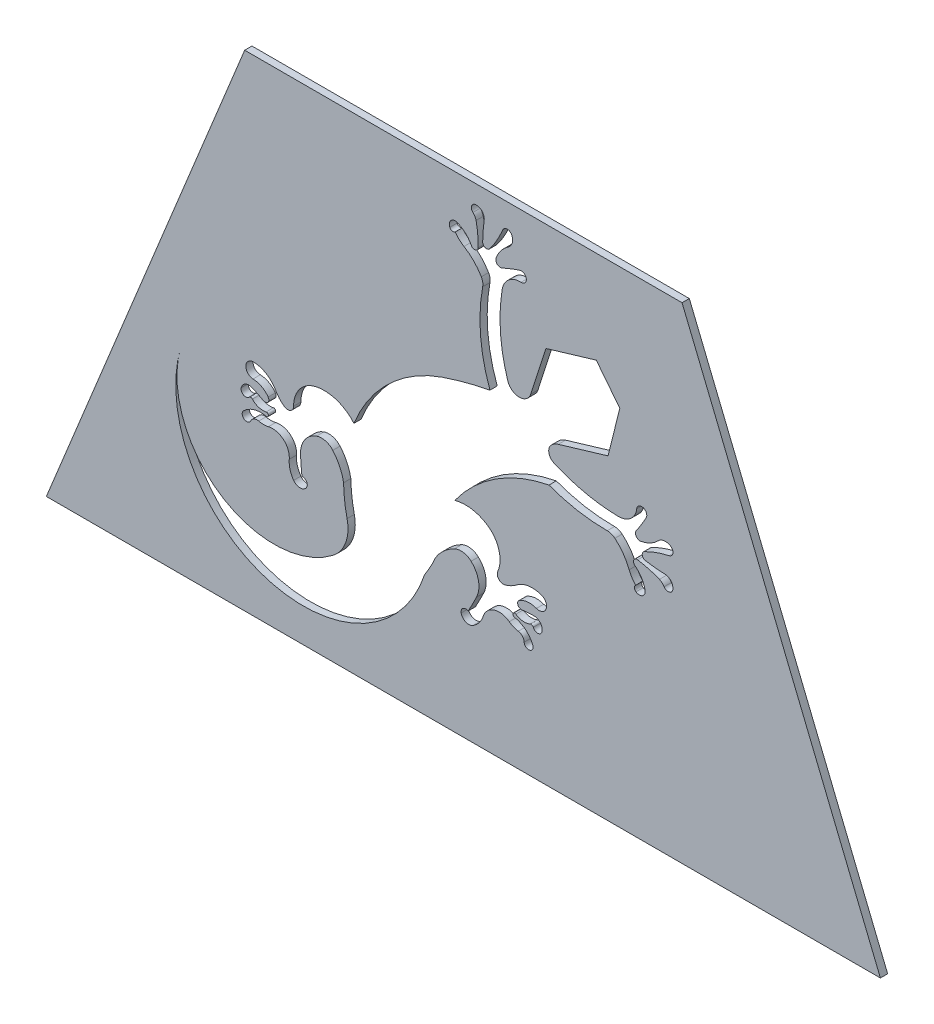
SolidWorks part; units mm, degrees
ref_plane "Front Plane" through (0, 0, 0) normal (0, 0, 1) x (1, 0, 0)
ref_plane "Top Plane" through (0, 0, 0) normal (0, 1, 0) x (1, 0, 0)
ref_plane "Right Plane" through (0, 0, 0) normal (1, 0, 0) x (0, 0, -1)
sketch "Model" plane through (0, 0, 0) normal (0, 0, 1) x (1, 0, 0)
  line L0 (77.3625, 1404.6306) -> (97.9103, 1378.4881)
  line L1 (97.9103, 1378.4881) -> (87.6364, 1337.298)
  line L2 (77.3625, 1404.6306) -> (33.3316, 1391.5022)
  line L3 (33.3316, 1391.5022) -> (20.0415, 1350.2377)
  line L4 (87.6364, 1337.298) -> (44.1906, 1324.3441)
  line L32 (-403.4791, 1061.0287) -> (325.7465, 1061.0287)
  line L33 (325.7465, 1061.0287) -> (152.3405, 1485.635)
  line L34 (-403.4791, 1061.0287) -> (-230.0732, 1485.635)
  line L35 (-230.0732, 1485.635) -> (152.3405, 1485.635)
  arc A0 (44.1906, 1324.3441) -> (38.0009, 1320.6636) centre (48.4039, 1310.2131) ccw
  arc A1 (20.0415, 1350.2377) -> (0, 1350.2377) centre (10.0208, 1353.4651) cw
  arc A2 (0, 1350.2377) -> (-6.7675, 1391.5022) centre (134.0391, 1393.4077) cw
  arc A3 (-46.6936, 1199.7645) -> (-63.0447, 1185.1547) centre (-28.8124, 1163.2973) ccw
  arc A4 (-134.5557, 1250.8437) -> (-167.3054, 1262.0877) centre (-160.5312, 1228.5025) ccw
  arc A5 (-34.6238, 1158.7666) -> (-27.4172, 1172.761) centre (-353.3472, 1331.7503) ccw
  arc A6 (-40.8021, 1154.1136) -> (-34.6238, 1158.7666) centre (-36.6514, 1155.0307) cw
  arc A7 (-30.4945, 1149.7926) -> (-40.8021, 1154.1136) centre (-34.1241, 1155.5891) cw
  arc A8 (-21.5605, 1161.2621) -> (-30.4945, 1149.7926) centre (-41.7576, 1167.7801) cw
  arc A9 (1.2378, 1168.5995) -> (-21.5605, 1161.2621) centre (-7.5225, 1156.7317) ccw
  arc A10 (9.1107, 1165.2992) -> (1.2378, 1168.5995) centre (11.9489, 1183.11) cw
  arc A11 (14.2698, 1159.5274) -> (9.1107, 1165.2992) centre (8.146, 1159.2452) ccw
  arc A12 (21.7882, 1161.2217) -> (14.2698, 1159.5274) centre (18.1793, 1159.7075) cw
  arc A13 (-134.5557, 1250.8437) -> (-57.4112, 1324.3441) centre (-15.9404, 1203.5823) cw
  arc A14 (-181.2539, 1203.7013) -> (-167.3054, 1224.8383) centre (-160.0909, 1204.9065) cw
  arc A15 (-167.3054, 1224.8383) -> (-153.0365, 1221.1526) centre (-162.8642, 1212.5685) cw
  arc A16 (-167.3054, 1262.0877) -> (-187.2958, 1237.4819) centre (-162.3787, 1237.6618) ccw
  arc A17 (-187.2958, 1237.4819) -> (-195.6404, 1233.2911) centre (-192.5015, 1237.4443) cw
  arc A18 (-195.6404, 1233.2911) -> (-203.2139, 1241.9514) centre (-178.6085, 1255.8272) cw
  arc A19 (35.9997, 1289.4046) -> (-46.351, 1236.589) centre (60.7967, 1160.1318) ccw
  arc A20 (-72.8009, 1167.0778) -> (-285.9602, 1232.9045) centre (-178.775, 1201.9522) cw
  arc A21 (-285.9602, 1232.9045) -> (-153.0365, 1141.5992) centre (-204.3314, 1209.3322) ccw
  arc A22 (-153.0365, 1141.5992) -> (-140.5423, 1175.6968) centre (-173.306, 1168.3643) ccw
  arc A23 (-140.5423, 1175.6968) -> (-143.6051, 1201.3573) centre (-15.9404, 1203.5823) cw
  arc A24 (-57.4112, 1324.3441) -> (-15.6188, 1335.4517) centre (41.5562, 1036.1543) cw
  arc A25 (-203.2139, 1241.9514) -> (-222.4563, 1253.3739) centre (-222.7728, 1230.9215) ccw
  arc A26 (-222.4563, 1253.3739) -> (-222.7728, 1240.3491) centre (-222.5482, 1246.8599) ccw
  arc A27 (-222.7728, 1240.3491) -> (-209.568, 1233.2911) centre (-223.3587, 1223.3716) cw
  arc A28 (-209.568, 1233.2911) -> (-213.8023, 1228.5025) centre (-212.2286, 1231.3773) cw
  arc A29 (-213.8023, 1228.5025) -> (-223.3587, 1233.2911) centre (-284.425, 1099.4918) ccw
  arc A30 (-223.3587, 1233.2911) -> (-233.1071, 1228.5025) centre (-226.2727, 1226.9063) ccw
  arc A31 (-233.1071, 1228.5025) -> (-226.2727, 1224.8383) centre (-229.1972, 1227.5894) ccw
  arc A32 (-226.2727, 1224.8383) -> (-223.3587, 1224.8383) centre (-224.8157, 1223.4677) cw
  arc A33 (-223.3587, 1224.8383) -> (-211.3109, 1221.1139) centre (-214.053, 1233.5921) ccw
  arc A34 (-211.3109, 1221.1139) -> (-211.3109, 1217.8633) centre (-210.9537, 1219.4886) cw
  arc A35 (-211.3109, 1217.8633) -> (-224.8157, 1216.4111) centre (-215.8971, 1196.9933) ccw
  arc A36 (-224.8157, 1216.4111) -> (-231.0945, 1212.0826) centre (-215.5705, 1196.2823) ccw
  arc A37 (-231.0945, 1212.0826) -> (-224.8157, 1207.6133) centre (-228.3516, 1209.2909) ccw
  arc A38 (-224.8157, 1207.6133) -> (-217.8263, 1210.9418) centre (-219.2772, 1204.9856) cw
  arc A39 (-217.8263, 1210.9418) -> (-209.2897, 1210.9418) centre (-213.558, 1228.4649) ccw
  arc A40 (-209.2897, 1210.9418) -> (-191.1008, 1195.3608) centre (-205.7987, 1196.6099) cw
  arc A41 (-191.1008, 1195.3608) -> (-187.2957, 1181.3292) centre (-169.9542, 1193.5636) ccw
  arc A42 (-187.2957, 1181.3292) -> (-176.1191, 1181.3292) centre (-181.7074, 1185.2717) ccw
  arc A43 (-176.1191, 1181.3292) -> (-180.018, 1188.009) centre (-179.5924, 1183.7796) ccw
  arc A44 (-180.018, 1188.009) -> (-181.2539, 1203.7013) centre (180.7997, 1224.3202) cw
  arc A45 (-153.0365, 1221.1526) -> (-143.6051, 1201.3573) centre (-183.6259, 1194.4341) cw
  arc A46 (17.6711, 1167.641) -> (21.7882, 1161.2217) centre (1.3628, 1152.6517) cw
  arc A47 (5.7778, 1174.2015) -> (17.6711, 1167.641) centre (1.9389, 1153.1811) cw
  arc A48 (7.0345, 1177.1992) -> (5.7778, 1174.2015) centre (6.0768, 1175.8384) ccw
  arc A49 (19.5855, 1175.9763) -> (7.0345, 1177.1992) centre (14.3876, 1187.6471) cw
  arc A50 (22.2729, 1174.8497) -> (19.5855, 1175.9763) centre (20.3993, 1174.149) ccw
  arc A51 (29.9925, 1175.5868) -> (22.2729, 1174.8497) centre (26.0336, 1176.2562) cw
  arc A52 (22.8534, 1183.7718) -> (29.9925, 1175.5868) centre (23.0724, 1176.7569) cw
  arc A53 (12.1888, 1183.0502) -> (22.8534, 1183.7718) centre (27.4432, 1036.7674) cw
  arc A54 (10.135, 1189.1034) -> (12.1888, 1183.0502) centre (11.8489, 1186.3099) ccw
  arc A55 (25.0418, 1190.5075) -> (10.135, 1189.1034) centre (19.0184, 1174.6236) ccw
  arc A56 (29.7854, 1202.6419) -> (25.0418, 1190.5075) centre (27.3517, 1196.5989) cw
  arc A57 (7.6232, 1199.5469) -> (29.7854, 1202.6419) centre (21.397, 1181.813) cw
  arc A58 (-72.8009, 1167.0778) -> (-63.0447, 1185.1547) centre (-179.9225, 1236.5631) ccw
  arc A59 (-2.7097, 1194.488) -> (7.6232, 1199.5469) centre (-9.7044, 1221.8565) ccw
  arc A60 (-8.7852, 1201.579) -> (-2.7097, 1194.488) centre (-3.9987, 1199.5317) ccw
  arc A61 (-17.7083, 1232.0001) -> (-8.7852, 1201.579) centre (-31.6953, 1211.3782) cw
  arc A62 (-32.1093, 1197.6471) -> (-46.6936, 1199.7645) centre (-40.9488, 1188.0483) ccw
  arc A63 (-27.4172, 1172.761) -> (-32.1093, 1197.6471) centre (-46.4687, 1182.0543) ccw
  arc A64 (-46.351, 1236.589) -> (-17.7083, 1232.0001) centre (-36.9401, 1203.6453) cw
  arc A65 (-15.6188, 1335.4517) -> (-21.9863, 1410.524) centre (117.3333, 1384.5347) cw
  arc A66 (-6.7675, 1391.5022) -> (-4.9239, 1417.0244) centre (142.7978, 1393.5263) cw
  arc A67 (-4.9239, 1417.0244) -> (1.9389, 1428.0166) centre (11.4935, 1414.4129) cw
  arc A68 (1.9389, 1428.0166) -> (11.4935, 1430.6692) centre (10.4478, 1415.9018) cw
  arc A69 (11.4935, 1430.6692) -> (10.4478, 1439.2543) centre (11.8047, 1435.0634) ccw
  arc A70 (10.4478, 1439.2543) -> (-4.9239, 1433.2546) centre (53.5576, 1306.111) ccw
  arc A71 (-4.9239, 1433.2546) -> (-10.2828, 1438.2063) centre (-6.5748, 1436.8436) cw
  arc A72 (-10.2828, 1438.2063) -> (0.3798, 1451.8517) centre (16.2657, 1428.4499) cw
  arc A73 (0.3798, 1451.8517) -> (3.5237, 1462.2748) centre (-4.4736, 1459.0014) ccw
  circle A74 centre (-5.0984, 1464.7823) radius 0.0983
  arc A75 (3.5237, 1462.2748) -> (-4.4736, 1462.2748) centre (-0.475, 1460.6381) ccw
  arc A76 (-27.8376, 1469.7146) -> (-30.4945, 1462.55) centre (-27.789, 1465.6217) ccw
  arc A77 (-30.4945, 1462.55) -> (-27.7525, 1457.8585) centre (-36.2074, 1456.064) cw
  arc A78 (-4.4736, 1462.2748) -> (-15.9404, 1442.321) centre (-84.7379, 1495.1282) cw
  arc A79 (-15.9404, 1442.321) -> (-21.9769, 1444.4127) centre (-18.6108, 1444.3708) cw
  arc A80 (-21.9769, 1444.4127) -> (-20.6587, 1461.542) centre (111.5926, 1442.7489) cw
  arc A81 (-20.6587, 1461.542) -> (-27.8376, 1469.7146) centre (-27.7525, 1462.55) ccw
  arc A82 (-27.7525, 1457.8585) -> (-25.8933, 1438.2063) centre (-112.0247, 1439.9719) cw
  arc A83 (-25.8933, 1438.2063) -> (-31.8823, 1436.8436) centre (-29.0576, 1438.2712) cw
  arc A84 (-31.8823, 1436.8436) -> (-44.1684, 1448.0858) centre (-52.878, 1426.2329) ccw
  arc A85 (-44.1684, 1448.0858) -> (-50.7583, 1441.1899) centre (-46.0724, 1443.3086) ccw
  arc A86 (-50.7583, 1441.1899) -> (-46.0724, 1439.9719) centre (-47.9239, 1442.4715) ccw
  arc A87 (-46.0724, 1439.9719) -> (-38.307, 1432.8932) centre (-24.1815, 1456.1875) ccw
  arc A88 (-38.307, 1432.8932) -> (-23.1902, 1417.4931) centre (-60.9582, 1395.5392) cw
  arc A89 (-21.9863, 1410.524) -> (-23.1902, 1417.4931) centre (-31.974, 1412.3872) ccw
  arc A90 (86.9692, 1280.3102) -> (93.6167, 1277.8961) centre (87.0416, 1270.1505) cw
  arc A91 (106.1091, 1260.3001) -> (93.6167, 1277.8961) centre (65.3457, 1244.5922) ccw
  arc A92 (111.7073, 1251.408) -> (106.1091, 1260.3001) centre (131.5297, 1270.0957) cw
  arc A93 (112.0797, 1246.5806) -> (111.7073, 1251.408) centre (113.8411, 1249.1446) cw
  arc A94 (120.0298, 1251.851) -> (112.0797, 1246.5806) centre (114.9917, 1250.8194) cw
  arc A95 (111.1308, 1265.9274) -> (120.0298, 1251.851) centre (96.9833, 1247.1322) cw
  arc A96 (113.5284, 1271.5821) -> (111.1308, 1265.9274) centre (113.0342, 1268.456) ccw
  arc A97 (132.5446, 1266.2859) -> (113.5284, 1271.5821) centre (100.075, 1186.4896) ccw
  arc A98 (137.4215, 1272.6189) -> (144.1999, 1264.111) centre (137.1626, 1265.4584) cw
  arc A99 (120.3283, 1274.3425) -> (137.4215, 1272.6189) centre (142.2488, 1406.1115) ccw
  arc A100 (119.3341, 1280.6532) -> (120.3283, 1274.3425) centre (120.8807, 1277.6632) ccw
  arc A101 (140.9975, 1288.4209) -> (119.3341, 1280.6532) centre (159.1793, 1203.6205) ccw
  arc A102 (136.679, 1262.7594) -> (132.5446, 1266.2859) centre (129.287, 1258.28) ccw
  arc A103 (144.1999, 1264.111) -> (136.679, 1262.7594) centre (140.1796, 1264.8808) cw
  arc A104 (142.408, 1296.2929) -> (140.9975, 1288.4209) centre (140.0917, 1292.6456) cw
  circle A105 centre (143.3555, 1287.3637) radius 0.0983
  arc A106 (131.5938, 1295.0366) -> (142.408, 1296.2929) centre (137.7754, 1288.9982) cw
  arc A107 (116.2817, 1286.9479) -> (131.5938, 1295.0366) centre (111.3607, 1314.8009) ccw
  arc A108 (112.3528, 1293.0961) -> (116.2817, 1286.9479) centre (115.5944, 1290.8381) ccw
  arc A109 (120.9696, 1307.1686) -> (112.3528, 1293.0961) centre (-2.483, 1373.0857) cw
  arc A110 (112.7035, 1309.7122) -> (120.9696, 1307.1686) centre (117.0837, 1309.2435) cw
  arc A111 (108.4073, 1300.7751) -> (112.7035, 1309.7122) centre (97.9832, 1311.2874) ccw
  arc A112 (96.377, 1295.9587) -> (108.4073, 1300.7751) centre (96.702, 1312.5794) ccw
  arc A113 (70.9298, 1298.6455) -> (96.377, 1295.9587) centre (99.3016, 1445.5091) ccw
  arc A114 (35.9997, 1289.4046) -> (86.9692, 1280.3102) centre (85.9597, 1422.0296) ccw
  arc A115 (38.0009, 1320.6636) -> (40.2725, 1308.3042) centre (43.3767, 1315.2632) ccw
  arc A116 (40.2725, 1308.3042) -> (70.9298, 1298.6455) centre (97.6401, 1436.9085) ccw
  dimension "D1" = 10.16
  dimension "D2" = 7.62
extrude "Boss-Extrude1" add sketch "Model" along normal blind 6.35
